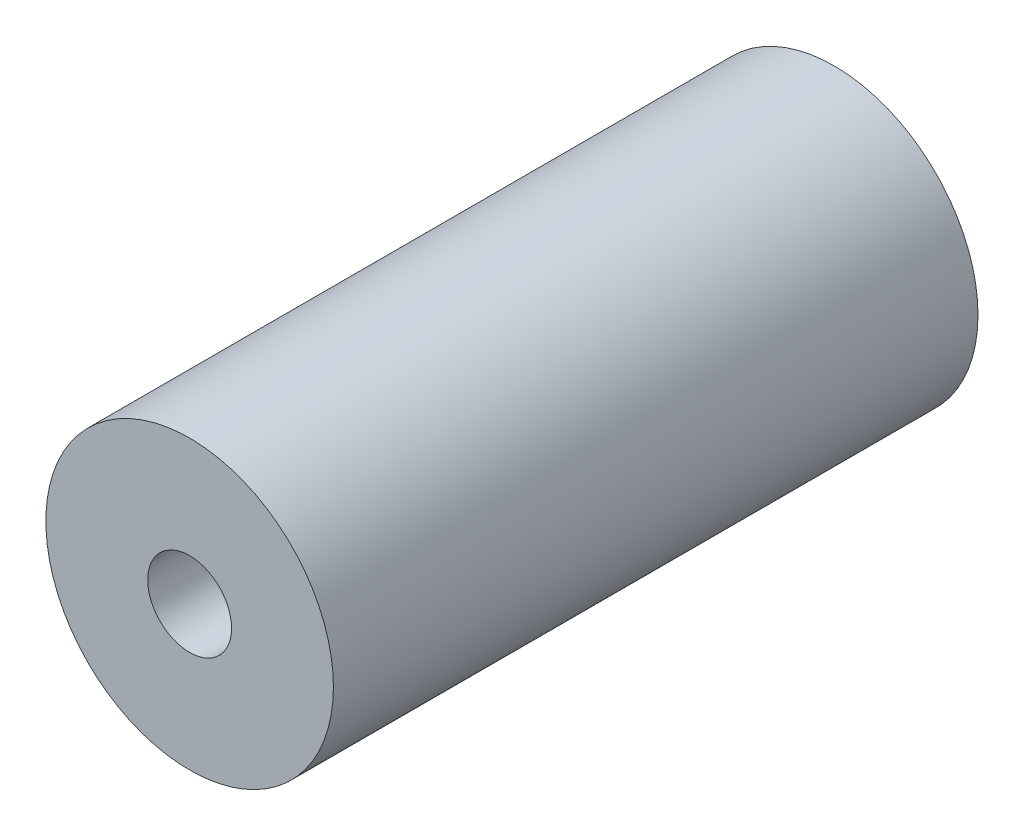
SolidWorks part; units mm, degrees
ref_plane "Plan de face" through (0, 0, 0) normal (0, 0, 1) x (1, 0, 0)
ref_plane "Plan de dessus" through (0, 0, 0) normal (0, 1, 0) x (1, 0, 0)
ref_plane "Plan de droite" through (0, 0, 0) normal (1, 0, 0) x (0, 0, -1)
sketch "Esquisse1" plane through (0, 0, 0) normal (0, 0, 1) x (1, 0, 0)
  circle A0 centre (0, 0) radius 1.75
  circle A1 centre (0, 0) radius 6
  dimension "D1" = 3.5
  dimension "D2" = 12
extrude "Boss.-Extru.1" add sketch "Esquisse1" along normal blind 26.9
